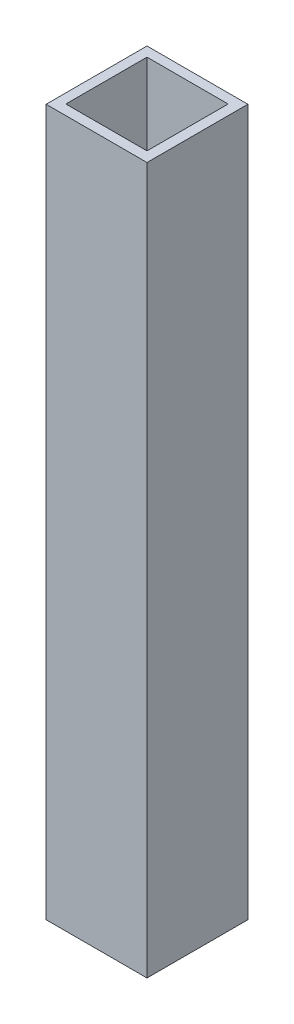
SolidWorks part; units mm, degrees
ref_plane "Plan de face" through (0, 0, 0) normal (0, 0, 1) x (1, 0, 0)
ref_plane "Plan de dessus" through (0, 0, 0) normal (0, 1, 0) x (1, 0, 0)
ref_plane "Plan de droite" through (0, 0, 0) normal (1, 0, 0) x (0, 0, -1)
sketch "Esquisse1" plane through (0, 0, 0) normal (0, 1, 0) x (1, 0, 0)
  line L1 (-4.9786, -5.0214) -> (5.0214, -5.0214)
  line L2 (-4.9786, -5.0214) -> (-4.9786, 4.9786)
  line L3 (-4.9786, 4.9786) -> (5.0214, 4.9786)
  line L4 (5.0214, -5.0214) -> (5.0214, 4.9786)
  line L5 (-4.9786, -5.0214) -> (5.0214, 4.9786) construction
  line L6 (-4.9786, 4.9786) -> (5.0214, -5.0214) construction
  line L7 (-4.0214, 4.0214) -> (4.0214, 4.0214)
  line L8 (-4.0214, 4.0214) -> (-4.0214, -4.0214)
  line L9 (-4.0214, -4.0214) -> (4.0214, -4.0214)
  line L10 (4.0214, 4.0214) -> (4.0214, -4.0214)
  line L11 (-4.0214, 4.0214) -> (4.0214, -4.0214) construction
  line L12 (-4.0214, -4.0214) -> (4.0214, 4.0214) construction
  point P0 (0, 0)
  dimension "D1" = 10
  dimension "D2" = 10
  dimension "D3" = 1
extrude "Boss.-Extru.1" add sketch "Esquisse1" along normal blind 70
